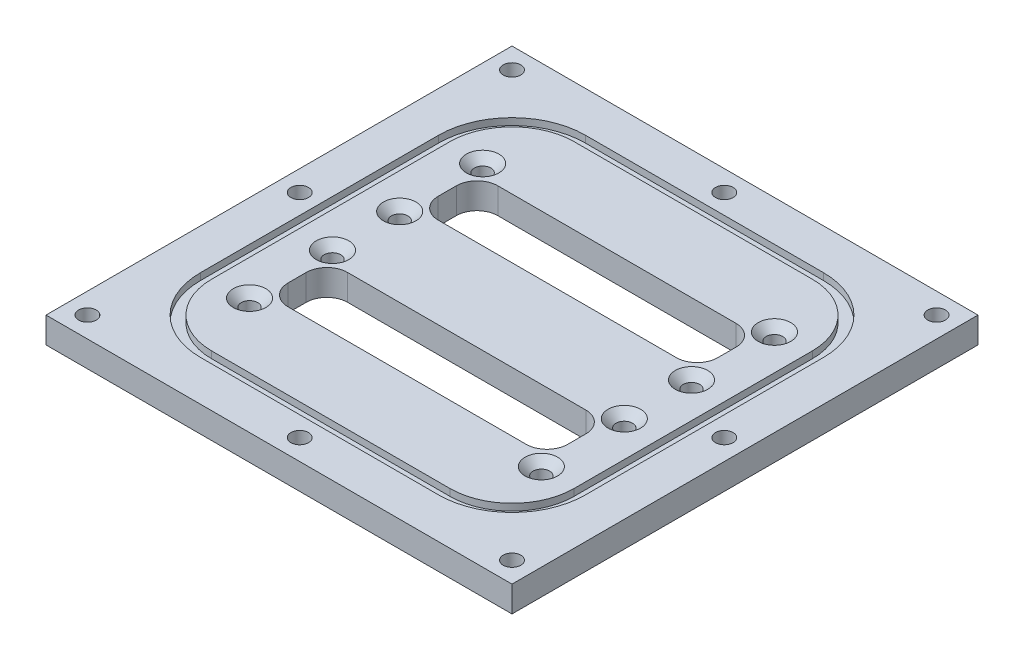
SolidWorks part; units mm, degrees
ref_plane "Front Plane" through (0, 0, 0) normal (0, 0, 1) x (1, 0, 0)
ref_plane "Top Plane" through (0, 0, 0) normal (0, 1, 0) x (1, 0, 0)
ref_plane "Right Plane" through (0, 0, 0) normal (1, 0, 0) x (0, 0, -1)
sketch "Sketch1" plane through (0, 0, 0) normal (0, 1, 0) x (1, 0, 0)
  line L1 (-45, -45) -> (45, -45)
  line L2 (-45, -45) -> (-45, 45)
  line L3 (-45, 45) -> (45, 45)
  line L4 (45, -45) -> (45, 45)
  line L5 (-45, -45) -> (45, 45) construction
  line L6 (-45, 45) -> (45, -45) construction
  point P0 (0, 0)
  dimension "D1" = 90
extrude "Boss-Extrude1" add sketch "Sketch1" along normal blind 5
sketch "Sketch2" plane through (0, 5, 0) normal (0, 1, 0) x (1, 0, 0)
  line L1 (-27, 20.25) -> (27, 20.25)
  line L2 (-27, 20.25) -> (-27, 8.75)
  line L3 (-27, 8.75) -> (27, 8.75)
  line L4 (27, 20.25) -> (27, 8.75)
  line L5 (-27, 20.25) -> (27, 8.75) construction
  line L6 (-27, 8.75) -> (27, 20.25) construction
  line L7 (-27, -8.75) -> (27, -8.75)
  line L8 (-27, -8.75) -> (-27, -20.25)
  line L9 (-27, -20.25) -> (27, -20.25)
  line L10 (27, -8.75) -> (27, -20.25)
  line L11 (-27, -8.75) -> (27, -20.25) construction
  line L12 (-27, -20.25) -> (27, -8.75) construction
  point P0 (0, 14.5)
  point P5 (0, -14.5)
  dimension "D1" = 14.5
  dimension "D2" = 14.5
  dimension "D3" = 54
  dimension "D4" = 11.5
extrude "Cut-Extrude1" cut sketch "Sketch2" against normal through all
fillet "Fillet1" radius 4 8 edges at (-27, 2.5, 8.75) (-27, 2.5, 20.25) (-27, 2.5, -8.75) (27, 2.5, -8.75) (27, 2.5, 20.25) (27, 2.5, 8.75) (27, 2.5, -20.25) (-27, 2.5, -20.25)
hole_wizard "CSK for M3 Flat Head Machine Screw1" positions "Sketch4" profile "Sketch5" countersink size "M3" standard "Ansi Metric"
sketch "Sketch4" plane through (0, 5, 0) normal (0, 1, 0) x (-1, 0, 0)
  line L0 (-27, 14.5) -> (27, 14.5) construction
  line L1 (-27, 16.25) -> (-27, 12.75) construction
  line L2 (27, 12.75) -> (27, 16.25) construction
  line L4 (-27, -14.5) -> (27, -14.5) construction
  line L5 (-27, -12.75) -> (-27, -16.25) construction
  line L6 (27, -16.25) -> (27, -12.75) construction
  point P0 (28.18, -6.49)
  point P1 (28.18, -22.51)
  point P3 (-28.18, -22.51)
  point P5 (-28.18, -6.49)
  point P7 (28.18, 6.49)
  point P9 (-28.18, 6.49)
  point P11 (-28.18, 22.51)
  point P13 (28.18, 22.51)
  dimension "D1" = 8.01
  dimension "D2" = 16.02
  dimension "D3" = 8.01
  dimension "D4" = 16.02
  dimension "D5" = 28.18
  dimension "D6" = 56.36
sketch "Sketch5" plane through (-28.18, 5, -6.49) normal (1, 0, 0) x (0, 0, 1)
  line L0 (0, 0) -> (0, 5)
  line L1 (0, 5) -> (1.6, 5)
  line L2 (1.6, 5) -> (1.6, 1.55)
  line L3 (1.6, 1.55) -> (3.15, 0)
  line L5 (3.15, 0) -> (0, 0)
  line L6 (-1.6, 1.55) -> (-3.15, 0) construction
  line L11 (0, -6.35) -> (0, 107.95) construction
  dimension "Thru Hole Dia." = 3.2
  dimension "Thru Hole Depth" = 5
  dimension "Near C'Sink Dia." = 6.3
  dimension "Near C'Sink Angle" = 90
hole_wizard "Ø3.4 (3.4) Diameter Hole1" positions "Sketch8" profile "Sketch7" hole size "Ø3.4" standard "Ansi Metric"
sketch "Sketch8" plane through (0, 0, 0) normal (0, -1, 0) x (1, 0, 0)
  line L0 (-45, -45) -> (-45, 45) construction
  line L1 (45, 45) -> (45, -45) construction
  line L2 (-45, 45) -> (45, 45) construction
  line L3 (45, -45) -> (-45, -45) construction
  point P0 (-41, 41)
  point P1 (0, 41)
  point P3 (41, 41)
  point P5 (41, 0)
  point P7 (41, -41)
  point P9 (0, -41)
  point P11 (-41, -41)
  point P13 (-41, 0)
  dimension "D1" = 4
  dimension "D2" = 4
  dimension "D3" = 4
  dimension "D4" = 4
sketch "Sketch7" plane through (-41, 0, 41) normal (1, 0, 0) x (0, 0, -1)
  line L0 (0, 0) -> (0, 5)
  line L1 (0, 5) -> (1.7, 5)
  line L2 (1.7, 5) -> (1.7, 0)
  line L5 (1.7, 0) -> (0, 0)
  line L11 (0, -6.35) -> (0, 107.95) construction
  dimension "Thru Hole Dia." = 3.4
  dimension "Thru Hole Depth" = 5
sketch "Sketch9" plane through (0, 5, 0) normal (0, 1, 0) x (1, 0, 0)
  line L0 (23, -37.1717) -> (-23, -37.1717)
  line L1 (23, -35) -> (-23, -35)
  line L2 (35, -23) -> (35, 23)
  line L3 (23, 35) -> (-23, 35)
  line L4 (-35, -23) -> (-35, 23)
  line L5 (-37.1717, -23) -> (-37.1717, 23)
  line L6 (23, 37.1717) -> (-23, 37.1717)
  line L7 (37.1717, -23) -> (37.1717, 23)
  arc A0 (23, -35) -> (35, -23) centre (23, -23) ccw
  arc A1 (-35, -23) -> (-23, -35) centre (-23, -23) ccw
  arc A2 (35, 23) -> (23, 35) centre (23, 23) ccw
  arc A3 (-23, 35) -> (-35, 23) centre (-23, 23) ccw
  arc A4 (-37.1717, -23) -> (-23, -37.1717) centre (-23, -23) ccw
  arc A5 (-23, 37.1717) -> (-37.1717, 23) centre (-23, 23) ccw
  arc A6 (37.1717, 23) -> (23, 37.1717) centre (23, 23) ccw
  arc A7 (23, -37.1717) -> (37.1717, -23) centre (23, -23) ccw
  dimension "D5" = 24
  dimension "D1" = 35
  dimension "D2" = 70
  dimension "D3" = 35
  dimension "D4" = 70
  dimension "D6" = 2.1717
extrude "Cut-Extrude2" cut sketch "Sketch9" against normal blind 1.3208
